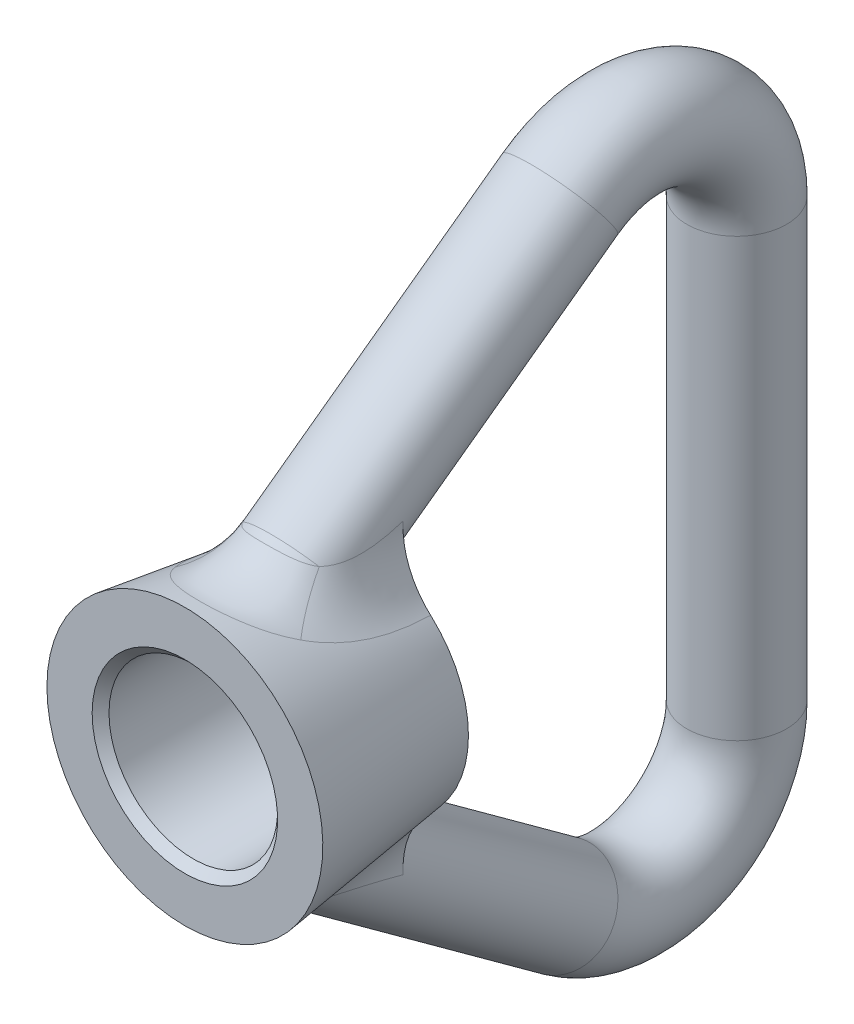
SolidWorks part; units mm, degrees
ref_plane "Front" through (0, 0, 0) normal (0, 0, 1) x (1, 0, 0)
ref_plane "Top" through (0, 0, 0) normal (0, 1, 0) x (1, 0, 0)
ref_plane "Right" through (0, 0, 0) normal (1, 0, 0) x (0, 0, -1)
other "Configuration Table"
sketch "Sketch1" plane through (0, 0, 0) normal (0, 1, 0) x (1, 0, 0)
  line L0 (0, 91.5074) -> (0, -17.3649) construction
  line L1 (0, 0) -> (18, 0)
  line L2 (18, 0) -> (15, 22)
  line L3 (15, 22) -> (0, 22)
  line L4 (0, 22) -> (0, 0)
revolve "BaseNut" add sketch "Sketch1" angle 360 about L0
sketch "Sketch2" plane through (0, 38.5, 38.5) normal (1, 0, 0) x (0, -1, 0)
  line L0 (38.5, 110.5) -> (38.5, 38.5) construction
  line L1 (23.5, 60.5) -> (20.5, 38.5) construction
  line L2 (38.5, 47.5) -> (34.7544, 47.5)
  line L3 (23.0321, 53.4654) -> (-1.7222, 87.4654)
  line L4 (10, 110.5) -> (67, 110.5)
  line L5 (53.9679, 53.4654) -> (78.7222, 87.4654)
  line L6 (38.5, 47.5) -> (42.2456, 47.5)
  line L10 (23.5, 60.5) -> (20.5, 38.5) construction
  line L11 (20.5, 38.5) -> (56.5, 38.5) construction
  line L14 (53.5, 60.5) -> (23.5, 60.5) construction
  arc A0 (-1.7222, 87.4654) -> (10, 110.5) centre (10, 96) cw
  arc A1 (34.7544, 47.5) -> (23.0321, 53.4654) centre (34.7544, 62) cw
  arc A2 (42.2456, 47.5) -> (53.9679, 53.4654) centre (42.2456, 62) ccw
  arc A3 (78.7222, 87.4654) -> (67, 110.5) centre (67, 96) ccw
  circle A4 centre (67, 96) radius 4 construction
  point P18 (38.5, 110.5)
  point P25 (22.6218, 54.0596)
ref_plane "RefPlane" through (0, 3.7456, -9) normal (0, 1, 0) x (-1, 0, 0)
sketch "Sketch3" plane through (0, 3.7456, 3) normal (0, 1, 0) x (1, 0, 0)
  circle A0 centre (0, 12) radius 6.5
sweep "WingTrim" add profiles "Sketch3" path "Sketch2"
fillet "Fillet1" radius 11 6 edges at (5.6007, -14.3501, -19.0347) (-5.9402, -14.3737, -17.946) (5.9402, 14.3737, -17.946) (-5.6007, 14.3501, -19.0347) (0.5782, -17.0021, -7.2462) (0.5782, 17.0021, -7.2462)
sketch "Sketch4" plane through (3.9634, -0.4384, -22) normal (0, 0, -1) x (-1, 0, 0)
  circle A0 centre (3.9634, 0.4384) radius 11
  arc A1 (14.0324, -10.6798) -> (14.0324, 11.5567) centre (3.9634, 0.4384) ccw construction
extrude "Hole" cut sketch "Sketch4" against normal through all
chamfer "Chamfer1" distance 1.1 angle 45 1 edges at (-11, 0, 0)
sketch "Sketch5" plane through (0, 0, 0) normal (1, 0, 0) x (0, 0, -1)
  line L0 (-17.3072, 0) -> (33.4909, 0) construction
  line L1 (0.6, -10) -> (1.6, -10)
  line L2 (1.6, -10) -> (1.6, -11)
  line L3 (1.6, -11) -> (1.1, -11.866)
  line L4 (1.1, -11.866) -> (0.6, -11)
  line L5 (0.6, -11) -> (0.6, -10)
  line L6 (1.1, -11) -> (1.1, 11) construction
revolve "Cut-Revolve10" [suppressed] cut sketch "Sketch5" angle 360 about L0
pattern_linear "LPattern10" [suppressed] count 17 spacing 1.2 along (0, 0, 1)
equation "\"D4@Sketch2\" = \"d@Sketch3\""
equation "\"D5@Sketch2\" = \"D4@Sketch2\" / 2"
equation "\"D1@Chamfer1\" = \"xd@Sketch4\" / 20"
equation "\"d2@Sketch2\" = \"R@Sketch2\" + \"d@Sketch3\" / 2"
equation "\"D2@Sketch5\" = \"xd@Sketch4\""
equation "\"D1@Sketch5\" = (  \"D2@ThreadCosmetic1\" - \"xd@Sketch4\" )  / 2"
equation "\"D3@LPattern10\" = \"D1@Sketch5\" * 1.2"
equation "\"D1@LPattern10\" = \"m@Sketch1\" / \"D3@LPattern10\"-1"
